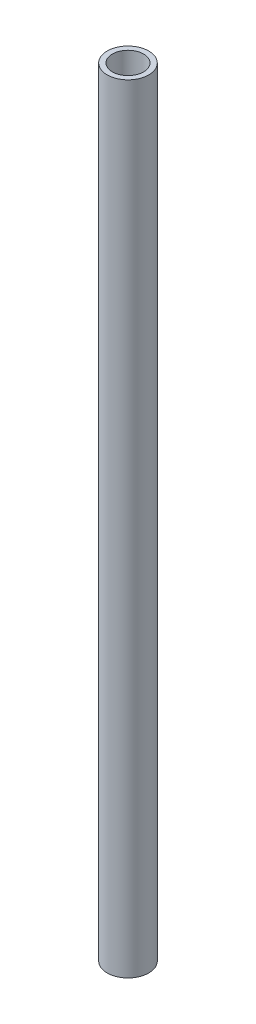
SolidWorks part; units mm, degrees
ref_plane "Ebene vorne" through (0, 0, 0) normal (0, 0, 1) x (1, 0, 0)
ref_plane "Ebene oben" through (0, 0, 0) normal (0, 1, 0) x (1, 0, 0)
ref_plane "Ebene rechts" through (0, 0, 0) normal (1, 0, 0) x (0, 0, -1)
sketch "Skizze1" plane through (0, 0, 0) normal (0, 1, 0) x (1, 0, 0)
  circle A0 centre (0, 0) radius 4
  circle A1 centre (0, 0) radius 3
extrude "Aufsatz-Linear austragen1" add sketch "Skizze1" along normal blind 150
